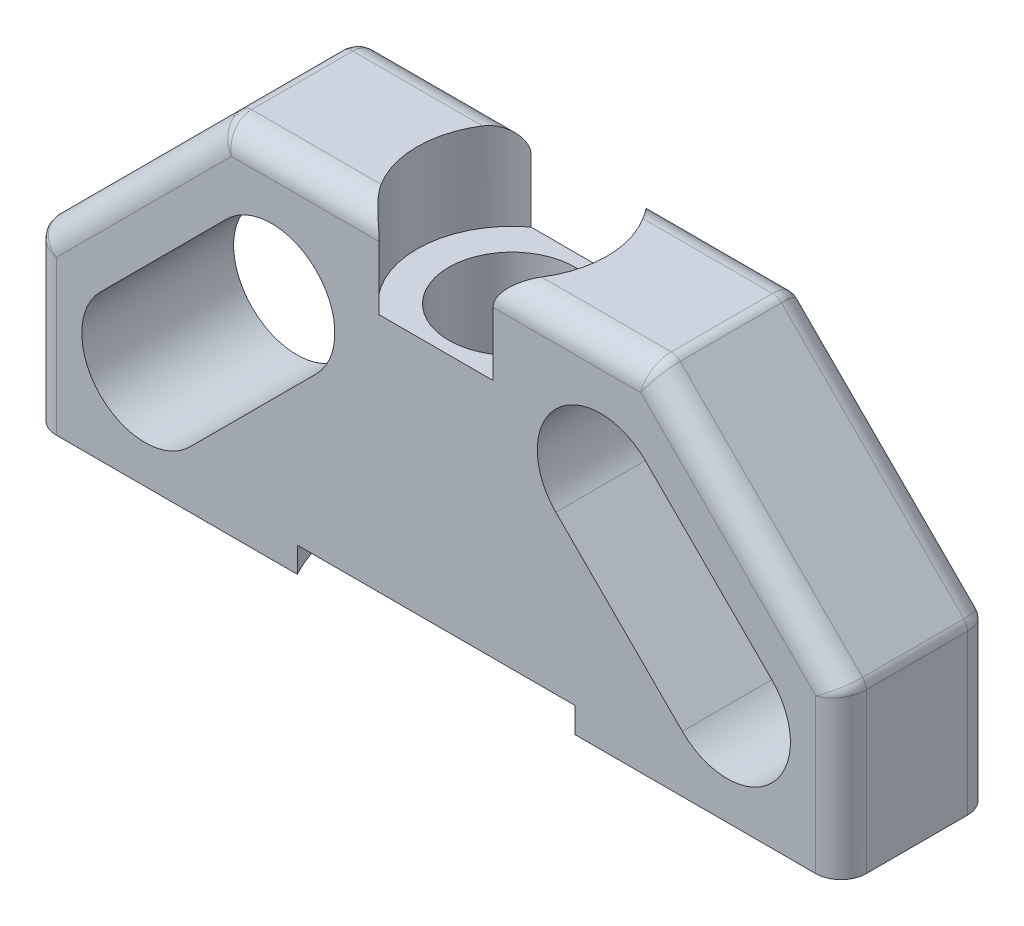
SolidWorks part; units mm, degrees
ref_plane "Plan1" through (0, 0, 0) normal (0, 0, 1) x (1, 0, 0)
ref_plane "Plan2" through (0, 0, 0) normal (0, 1, 0) x (1, 0, 0)
ref_plane "Plan3" through (0, 0, 0) normal (1, 0, 0) x (0, 0, -1)
sketch "Esquisse1" plane through (0, 0, 0) normal (0, 0, 1) x (1, 0, 0)
  line L0 (0, 0) -> (16, 0)
  line L1 (0, 0) -> (0, 14)
  line L2 (16, 14) -> (0, 14)
  line L3 (16, 14) -> (16, 0)
  dimension "D1" = 16
  dimension "D2" = 14
extrude "brut" add sketch "Esquisse1" along normal blind 6
chamfer "Chanfrein1" distance 7.5 distance2 7.5 1 edges at (16, 14, 3)
sketch "Esquisse2" plane through (0, 0, 0) normal (0, 0, 1) x (1, 0, 0)
  line L0 (-1.8581, 17.3581) -> (11.4992, 4.0008) construction
  line L1 (0, 0) -> (0, 14) construction
  line L2 (4.7322, 7.2322) -> (9.7315, 2.233)
  line L3 (8.2678, 10.7678) -> (13.267, 5.7685)
  line L4 (8.5, 14) -> (0, 14) construction
  line L6 (0, 0) -> (16, 0) construction
  arc A0 (8.2678, 10.7678) -> (4.7322, 7.2322) centre (6.5, 9) ccw
  arc A1 (9.7315, 2.233) -> (13.267, 5.7685) centre (11.4992, 4.0008) ccw
  dimension "D2" = 5
  dimension "D3" = 5
  dimension "D1" = 45
  dimension "D4" = 7.07
  dimension "D5" = 6.5
  dimension "D6" = 5
  dimension "D7" = 4.9992
  dimension "D8" = 4.9992
extrude "trou oblong " cut sketch "Esquisse2" along normal through all
fillet "arrondi 1" radius 0.5 2 edges at (8.5, 14, 3) (16, 6.5, 3)
fillet "arrondi 3" radius 1 10 edges at (4.1464, 14, 6) (4.1464, 14, 0) (12.25, 10.25, 0) (16, 3.1464, 0) (15.9619, 6.4842, 0) (8.4842, 13.9619, 0) (12.25, 10.25, 6) (16, 3.1464, 6) (15.9619, 6.4842, 6) (8.4842, 13.9619, 6)
mirror "symétrie"
sketch "Esquisse3" plane through (0, 14, 0) normal (0, 1, 0) x (-1, 0, 0)
  circle A0 centre (0, 3) radius 3.75
  dimension "D1" = 7.5
  dimension "D2" = 3
extrude "lamage" cut sketch "Esquisse3" against normal blind 3.5
sketch "Esquisse4" plane through (0, 10.5, 0) normal (0, 1, 0) x (-1, 0, 0)
  circle A0 centre (0, 3) radius 2.5
  dimension "D1" = 5
extrude "perçage" cut sketch "Esquisse4" against normal through all
sketch "Esquisse5" plane through (0, 0, 0) normal (0, -1, 0) x (1, 0, 0)
  circle A0 centre (0, 3) radius 6.25
  dimension "D1" = 12.5
extrude "alèsage" cut sketch "Esquisse5" against normal blind 1
